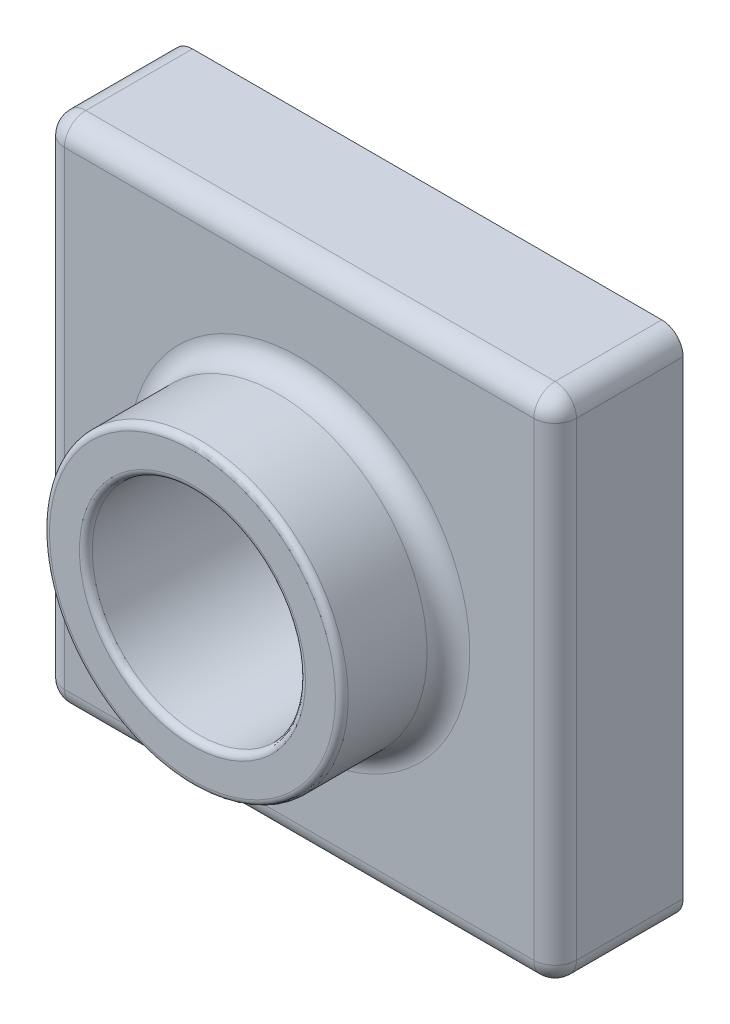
SolidWorks part; units mm, degrees
ref_plane "Front" through (0, 0, 0) normal (0, 0, 1) x (1, 0, 0)
ref_plane "Top" through (0, 0, 0) normal (0, 1, 0) x (1, 0, 0)
ref_plane "Right" through (0, 0, 0) normal (1, 0, 0) x (0, 0, -1)
sketch "Sketch1" plane through (0, 0, 0) normal (0, 0, 1) x (1, 0, 0)
  line L1 (0, 0) -> (120, 0)
  line L2 (0, 0) -> (0, 120)
  line L3 (0, 120) -> (120, 120)
  line L4 (120, 0) -> (120, 120)
  dimension "D1" = 120
  dimension "D2" = 120
extrude "Boss-Extrude1" add sketch "Sketch1" along normal blind 30
sketch "Sketch2" plane through (0, 0, 30) normal (0, 0, 1) x (1, 0, 0)
  line L0 (120, 120) -> (0, 120) construction
  line L1 (0, 120) -> (0, 0) construction
  circle A0 centre (60, 60) radius 35
  dimension "D1" = 70
  dimension "D2" = 60
  dimension "D3" = 60
extrude "Boss-Extrude2" add sketch "Sketch2" along normal blind 25
sketch "Sketch3" plane through (0, 0, 55) normal (0, 0, 1) x (1, 0, 0)
  circle A0 centre (60, 60) radius 25
  dimension "D1" = 50
extrude "Cut-Extrude1" cut sketch "Sketch3" against normal through all
fillet "Fillet1" radius 5 9 edges at (25, 60, 30) (60, 120, 30) (120, 60, 30) (60, 0, 30) (0, 60, 30) (0, 0, 15) (120, 0, 15) (120, 120, 15) (0, 120, 15)
fillet "Fillet2" radius 1.5 2 edges at (95, 60, 55) (85, 60, 55)
shell "Shell1" thickness 2
